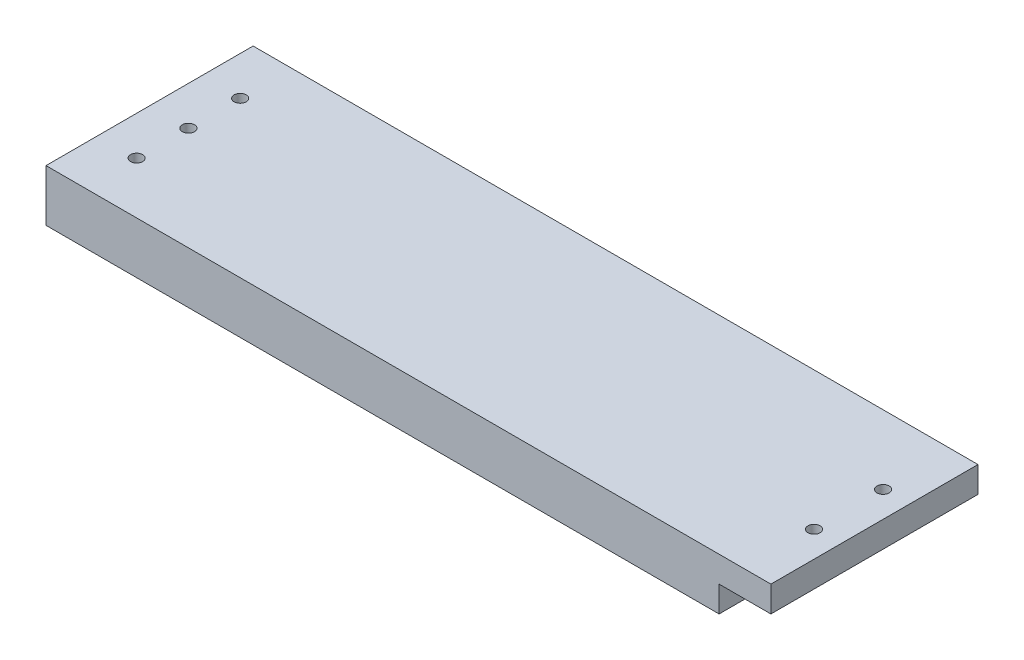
SolidWorks part; units mm, degrees
ref_plane "Front Plane" through (0, 0, 0) normal (0, 0, 1) x (1, 0, 0)
ref_plane "Top Plane" through (0, 0, 0) normal (0, 1, 0) x (1, 0, 0)
ref_plane "Right Plane" through (0, 0, 0) normal (1, 0, 0) x (0, 0, -1)
sketch "Sketch1" plane through (0, 0, 0) normal (0, 1, 0) x (1, 0, 0)
  line L1 (0, 0) -> (165.1, 0)
  line L2 (0, 0) -> (0, -50.8)
  line L3 (0, -50.8) -> (165.1, -50.8)
  line L4 (165.1, 0) -> (165.1, -50.8)
  dimension "D1" = 50.8
  dimension "D2" = 165.1
extrude "Boss-Extrude1" add sketch "Sketch1" along normal blind 12.7
sketch "Sketch2" plane through (0, 12.7, 0) normal (0, 1, 0) x (1, 0, 0)
  line L0 (0, 0) -> (9.525, 0) construction
  line L1 (165.1, 0) -> (0, 0) construction
  line L2 (9.525, 0) -> (19.05, 0) construction
  line L3 (19.05, 0) -> (19.05, -50.8) construction
  line L4 (0, -50.8) -> (165.1, -50.8) construction
  line L5 (0, 0) -> (0, -50.8) construction
  line L6 (9.525, 0) -> (9.525, -12.7) construction
  line L7 (9.525, -12.7) -> (9.525, -25.4) construction
  line L8 (9.525, -25.4) -> (9.525, -38.1) construction
  line L9 (9.525, -38.1) -> (9.525, -50.8) construction
  circle A0 centre (9.525, -12.7) radius 1.49
  circle A1 centre (9.525, -25.4) radius 1.49
  circle A2 centre (9.525, -38.1) radius 1.49
  dimension "D2" = 2.98
  dimension "D1" = 19.05
extrude "Cut-Extrude1" cut sketch "Sketch2" against normal through all
sketch "Sketch3" plane through (165.1, 0, 0) normal (1, 0, 0) x (0, 0, -1)
  line L0 (0, 12.7) -> (0, 0) construction
  line L1 (-50.8, 12.7) -> (0, 12.7)
  line L2 (-50.8, 12.7) -> (-50.8, 6.35)
  line L3 (-50.8, 6.35) -> (0, 6.35)
  line L4 (0, 12.7) -> (0, 6.35)
extrude "Boss-Extrude2" add sketch "Sketch3" along normal blind 12.7
sketch "Sketch4" plane through (0, 6.35, 0) normal (0, -1, 0) x (1, 0, 0)
  line L0 (171.45, 50.8) -> (171.45, 33.8667) construction
  line L1 (177.8, 50.8) -> (165.1, 50.8) construction
  line L2 (171.45, 33.8667) -> (171.45, 16.9333) construction
  line L3 (171.45, 16.9333) -> (171.45, 0) construction
  line L4 (177.8, 0) -> (165.1, 0) construction
  circle A0 centre (171.45, 33.8667) radius 1.49
  circle A1 centre (171.45, 16.9333) radius 1.49
  dimension "D1" = 2.98
extrude "Cut-Extrude2" cut sketch "Sketch4" against normal through all
